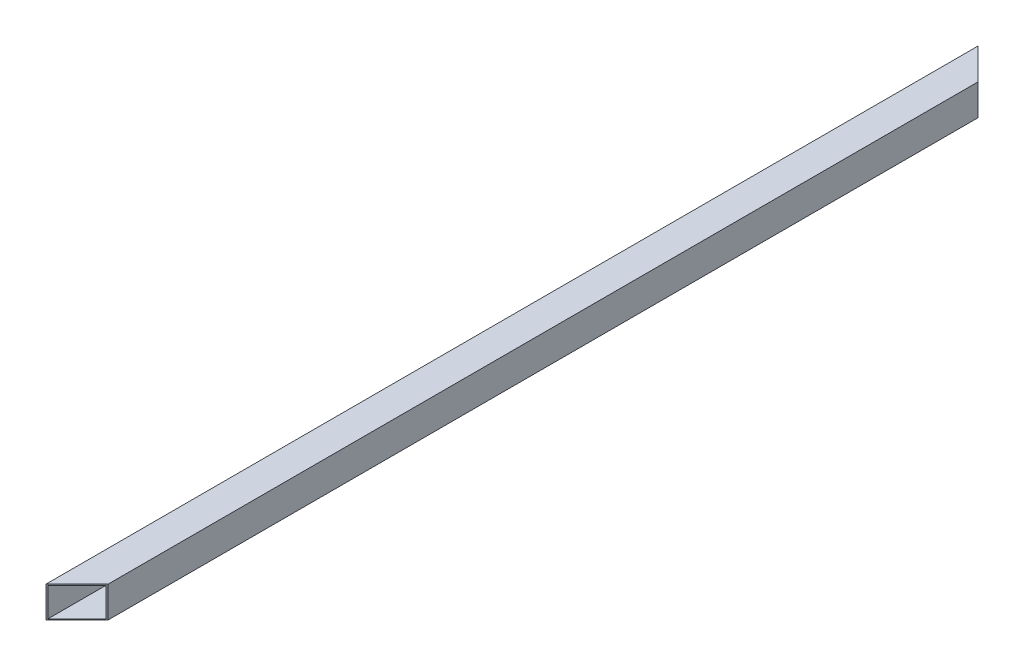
SolidWorks part; units mm, degrees
ref_plane "Piano frontale" through (0, 0, 0) normal (0, 0, 1) x (1, 0, 0)
ref_plane "Piano superiore" through (0, 0, 0) normal (0, 1, 0) x (1, 0, 0)
ref_plane "Piano destro" through (0, 0, 0) normal (1, 0, 0) x (0, 0, -1)
sketch "Schizzo1" plane through (0, 0, 0) normal (0, 0, 1) x (1, 0, 0)
  line L1 (-15, -15) -> (15, -15)
  line L2 (-15, -15) -> (-15, 15)
  line L3 (-15, 15) -> (15, 15)
  line L4 (15, -15) -> (15, 15)
  line L5 (-15, -15) -> (15, 15) construction
  line L6 (-15, 15) -> (15, -15) construction
  point P0 (0, 0)
  dimension "D1" = 30
  dimension "D2" = 30
extrude "Estrusione-Sottile1" add sketch "Schizzo1" along normal blind 900 thin
ref_plane "Piano1" through (0, 0, 450) normal (0, 0, -1) x (-1, 0, 0)
sketch "Schizzo3" plane through (0, 15, 0) normal (0, 1, 0) x (1, 0, 0)
  line L0 (-15, 0) -> (15, -30)
  line L1 (15, -900) -> (15, 0) construction
  line L2 (15, -30) -> (15, 0)
  line L3 (15, 0) -> (-15, 0)
  dimension "D1" = 45
extrude "Taglio-Estrusione1" cut sketch "Schizzo3" against normal up to next
mirror "Specchia1" about plane through (0, 0, 450) normal (0, 0, -1) of "Taglio-Estrusione1"
